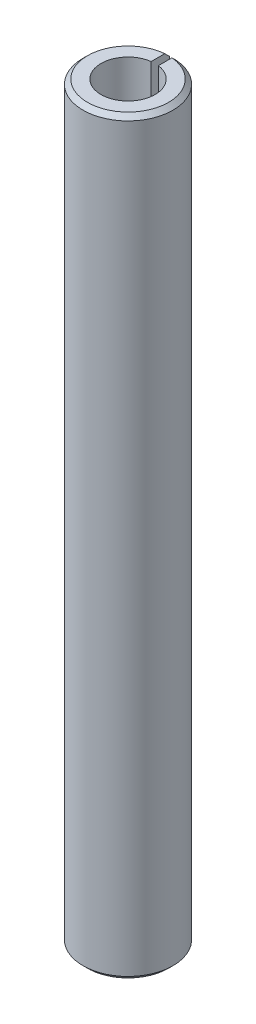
SolidWorks part; units mm, degrees
ref_plane "Face" through (0, 0, 0) normal (0, 0, 1) x (1, 0, 0)
ref_plane "Dessus" through (0, 0, 0) normal (0, 1, 0) x (1, 0, 0)
ref_plane "Droite" through (0, 0, 0) normal (1, 0, 0) x (0, 0, -1)
sketch "Esquisse1" plane through (0, 0, 0) normal (0, 0, 1) x (1, 0, 0)
  line L0 (0, -12.5) -> (0, 12.5) construction
  line L1 (-0.9, -12.5) -> (-0.9, 12.5)
  line L2 (-0.9, 12.5) -> (-1.35, 12.5)
  line L3 (-1.35, 12.5) -> (-1.5, 12.35)
  line L4 (-1.5, 12.35) -> (-1.5, -12.35)
  line L5 (-1.5, -12.35) -> (-1.35, -12.5)
  line L6 (-1.35, -12.5) -> (-0.9, -12.5)
  dimension "D1" = 25
  dimension "D2" = 0.15
  dimension "D3" = 3
  dimension "D4" = 0.6
  dimension "D5" = 45
  dimension "D6" = 45
revolve "Base-Révolution" add sketch "Esquisse1" angle 360 about L0
sketch "Esquisse2" plane through (0, 0, 0) normal (0, 1, 0) x (1, 0, 0)
  line L0 (0, 0) -> (0, 1.5) construction
  line L2 (-0.12, 1.4952) -> (-0.12, 0.892)
  line L4 (0.12, 1.4952) -> (0.12, 0.892)
  circle A0 centre (0, 0) radius 1.5 construction
  arc A1 (0.12, 1.4952) -> (-0.12, 1.4952) centre (0, 0) ccw
  circle A2 centre (0, 0) radius 0.9 construction
  arc A3 (0.12, 0.892) -> (-0.12, 0.892) centre (0, 0) ccw
  dimension "D1" = 0.24
extrude "Enlèv. mat.-Extru.2" cut sketch "Esquisse2" along normal through all and the other way through all
